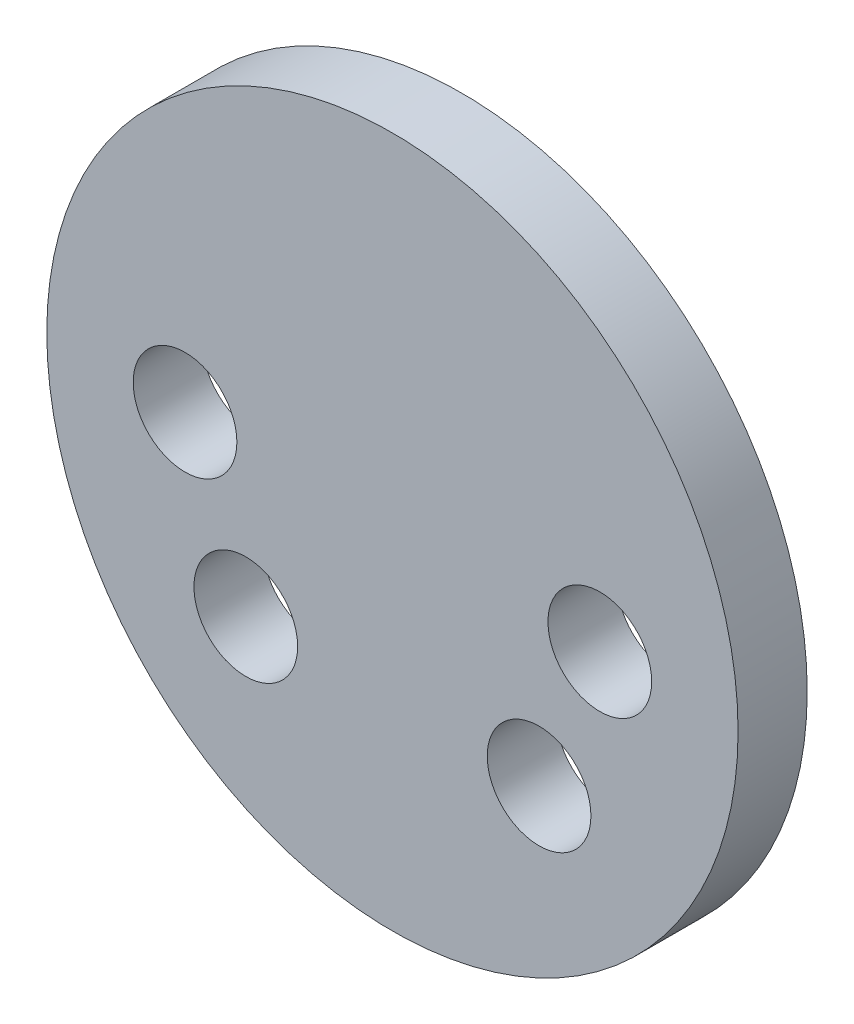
SolidWorks part; units mm, degrees
ref_plane "Front Plane" through (0, 0, 0) normal (0, 0, 1) x (1, 0, 0)
ref_plane "Top Plane" through (0, 0, 0) normal (0, 1, 0) x (1, 0, 0)
ref_plane "Right Plane" through (0, 0, 0) normal (1, 0, 0) x (0, 0, -1)
sketch "Sketch1" plane through (0, 0, 0) normal (0, 0, 1) x (1, 0, 0)
  line L0 (0, 0) -> (21.2132, -21.2132) construction
  line L1 (0, 0) -> (-21.2132, -21.2132) construction
  line L2 (-30, 0) -> (30, 0) construction
  arc A0 (-30, 0) -> (30, 0) centre (0, 0) ccw construction
  circle A1 centre (0, 0) radius 50
  circle A2 centre (-30, 0) radius 7.5
  circle A3 centre (-21.2132, -21.2132) radius 7.5
  circle A4 centre (21.2132, -21.2132) radius 7.5
  circle A5 centre (30, 0) radius 7.5
  dimension "D1" = 30
  dimension "D2" = 100
  dimension "D5" = 15
  dimension "D3" = 45
  dimension "D4" = 45
extrude "Extrude1" add sketch "Sketch1" along normal blind 10
